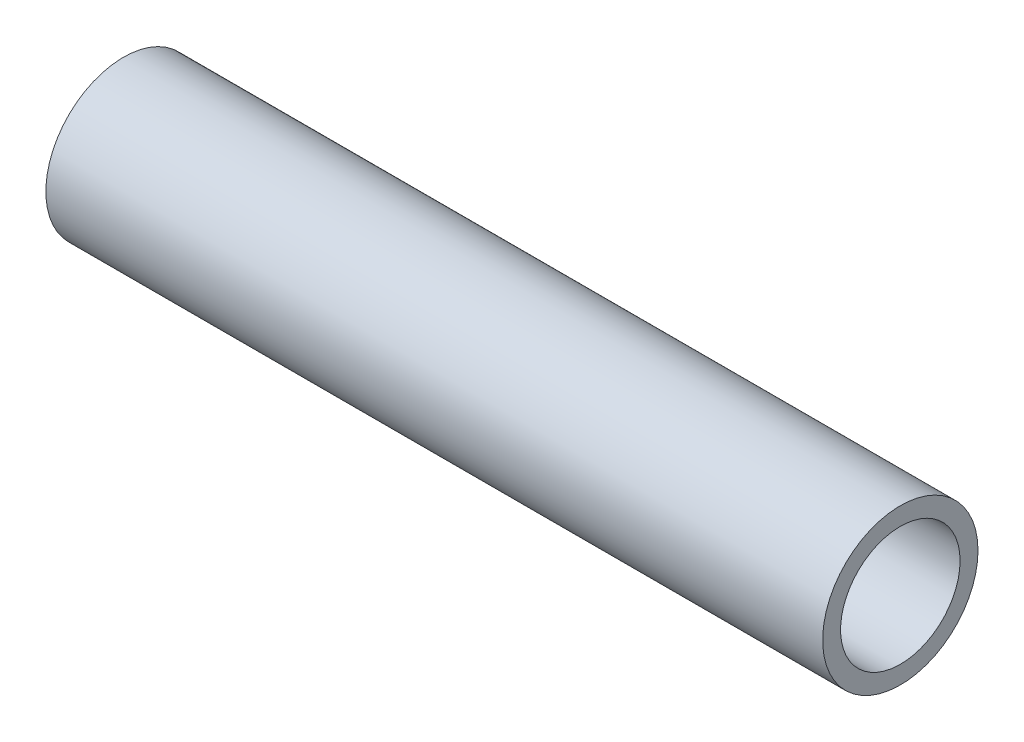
SolidWorks part; units mm, degrees
ref_plane "Front" through (0, 0, 0) normal (0, 0, 1) x (1, 0, 0)
ref_plane "Top" through (0, 0, 0) normal (0, 1, 0) x (1, 0, 0)
ref_plane "Right" through (0, 0, 0) normal (1, 0, 0) x (0, 0, -1)
sketch "Sketch1" plane through (0, 0, 0) normal (0, 0, 1) x (1, 0, 0)
  line L0 (0, 0) -> (165.1, 0)
  line L1 (9.9848, 0) -> (-9.9848, 0) construction
  dimension "D1" = 165.1
other "Structural Member1"
ref_plane "Plane1" through (0, 0, 0) normal (1, 0, 0) x (0, 0, -1)
sketch "Sketch11" plane through (0, 0, 0) normal (1, 0, 0) x (0, 0, -1)
  circle A0 centre (0, 0) radius 12.7
  circle A1 centre (0, 0) radius 16.51
  point P3 (0, 0)
  dimension "D1" = 33.02
  dimension "D2" = 25.4
